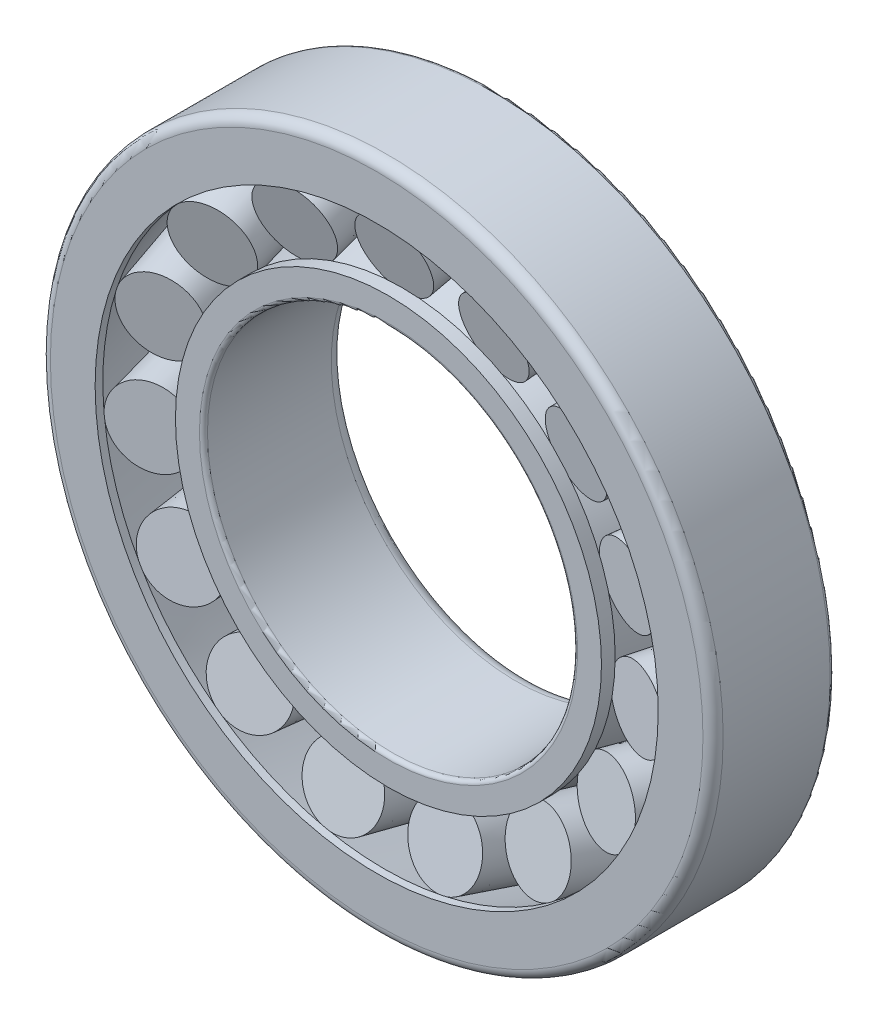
SolidWorks part; units mm, degrees
ref_plane "Front Plane" through (0, 0, 0) normal (0, 0, 1) x (1, 0, 0)
ref_plane "Top Plane" through (0, 0, 0) normal (0, 1, 0) x (1, 0, 0)
ref_plane "Right Plane" through (0, 0, 0) normal (1, 0, 0) x (0, 0, -1)
sketch "BaseSke" plane through (0, 0, 0) normal (1, 0, 0) x (0, 0, -1)
  line L0 (-47.2296, 0) -> (24.6132, 0) construction
  line L2 (0, 129.5214) -> (0, -86.3012) construction
  line L3 (8.7886, 44.1906) -> (-31.5386, 33.3094) construction
  line L4 (-22.75, 50) -> (-4.75, 50) construction
  line L5 (-21, 27.5) -> (0, 27.5) construction
  line L6 (-11.375, 38.75) -> (-18.4266, 64.8845) construction
  line L7 (-21.6125, 41.8693) -> (-5.8875, 46.5571)
  line L8 (-5.8875, 46.5571) -> (-4.2963, 40.66)
  line L9 (-4.2963, 40.66) -> (-20.1332, 36.3869)
  line L10 (-20.1332, 36.3869) -> (-21.6125, 41.8693)
  line L11 (-22.75, 50) -> (-22.75, 41.85) construction
  line L12 (-21.6073, 41.85) -> (-4.75, 46.8754) construction
  line L13 (-4.75, 50) -> (-4.75, 46.8754) construction
  line L14 (-21.6073, 41.85) -> (-22.75, 41.85) construction
  line L15 (-18.6539, 30.9044) -> (-2.7051, 34.7628) construction
  line L16 (-21, 27.5) -> (-21, 31.6627) construction
  line L17 (-21, 31.6627) -> (-18.9621, 31.6627) construction
  line L18 (0, 35.5211) -> (0, 27.5) construction
  line L19 (-18.9621, 31.6627) -> (-18.7642, 30.9292) construction
  line L20 (-18.7642, 30.9292) -> (-2.6209, 34.8346) construction
  line L21 (-2.6209, 34.8346) -> (-2.8062, 35.5211) construction
  line L22 (-2.8062, 35.5211) -> (0, 35.5211) construction
  dimension "D2" = 11.375
  dimension "D1" = 0.02
  dimension "Outer_Thickness" = 18
  dimension "Bearing_Outside_Diameter" = 100
  dimension "Bearing_Inside_Diameter" = 55
  dimension "Inner_Thickness" = 21
  dimension "Bearing_Thickness" = 22.75
  dimension "Angle" = 15.1
  dimension "D3" = 77.5
  dimension "D4" = 1.1375
  dimension "D5" = 1.1375
  dimension "D6" = 1.5
  dimension "D7" = 0.1
  dimension "Roller_diameter" = 83.7
  dimension "D8" = 0.7583
  dimension "D9" = 0.05
  dimension "D10" = 0.1
  dimension "D11" = 0.7583
revolve "Roller" add sketch "BaseSke" angle 360 about L3
sketch "OuterRaceSke" plane through (0, 0, 0) normal (1, 0, 0) x (0, 0, -1)
  line L0 (-21.6073, 41.85) -> (-22.75, 41.85) construction
  line L1 (-21.6073, 41.85) -> (-4.75, 46.8754) construction
  line L2 (-4.75, 50) -> (-4.75, 46.8754) construction
  line L3 (-22.75, 50) -> (-4.75, 50) construction
  line L4 (-22.75, 50) -> (-22.75, 41.85) construction
  line L5 (-21.6073, 41.85) -> (-22.75, 41.85)
  line L6 (-21.6073, 41.85) -> (-4.75, 46.8754)
  line L7 (-4.75, 50) -> (-4.75, 46.8754)
  line L8 (-22.75, 50) -> (-4.75, 50)
  line L9 (-22.75, 50) -> (-22.75, 41.85)
  line L10 (-60.3939, 0) -> (35.9926, 0) construction
revolve "OuterRace" add sketch "OuterRaceSke" angle 360 about L10
sketch "InnerRaceSke" plane through (0, 0, 0) normal (1, 0, 0) x (0, 0, -1)
  line L0 (-21, 27.5) -> (0, 27.5) construction
  line L1 (-21, 27.5) -> (-21, 31.6627) construction
  line L2 (-21, 31.6627) -> (-18.9621, 31.6627) construction
  line L3 (-18.9621, 31.6627) -> (-18.7642, 30.9292) construction
  line L4 (-18.7642, 30.9292) -> (-2.6209, 34.8346) construction
  line L5 (-2.6209, 34.8346) -> (-2.8062, 35.5211) construction
  line L6 (-2.8062, 35.5211) -> (0, 35.5211) construction
  line L7 (0, 35.5211) -> (0, 27.5) construction
  line L8 (-21, 27.5) -> (0, 27.5)
  line L9 (-21, 27.5) -> (-21, 31.6627)
  line L10 (-21, 31.6627) -> (-18.9621, 31.6627)
  line L11 (-18.9621, 31.6627) -> (-18.7642, 30.9292)
  line L12 (-18.7642, 30.9292) -> (-2.6209, 34.8346)
  line L13 (-2.6209, 34.8346) -> (-2.8062, 35.5211)
  line L14 (-2.8062, 35.5211) -> (0, 35.5211)
  line L15 (0, 35.5211) -> (0, 27.5)
  line L16 (-58.1022, 0) -> (39.538, 0) construction
revolve "InnerRace" add sketch "InnerRaceSke" angle 360 about L16
fillet "Fillet1" radius 0.6 2 edges at (50, 0, 4.75) (27.5, 0, 21)
fillet "InnerFillet" radius 2 1 edges at (27.5, 0, 0)
fillet "OuterFillet" radius 1.5 1 edges at (50, 0, 22.75)
pattern_circular "CirPatternBall" count 15 over 360 about axis through (0, 0, 0) along (0, 0, 1) of "Roller"
sketch "Sketch4" plane through (0, 0, 0) normal (1, 0, 0) x (0, 0, -1)
  line L0 (-21.6125, 41.8693) -> (-5.8875, 46.5571)
  line L1 (-5.8875, 46.5571) -> (-2.7051, 34.7628)
  line L2 (-2.7051, 34.7628) -> (-18.6539, 30.9044)
  line L3 (-18.6539, 30.9044) -> (-21.6125, 41.8693)
  line L4 (-40.3293, 0) -> (19.5574, 0) construction
revolve "Simplified" [suppressed] add sketch "Sketch4" angle 360 about L4
equation "\"D2@BaseSke\" = \"Bearing_Thickness@BaseSke\"/2"
equation "\"D3@BaseSke\" =  ( \"Bearing_Outside_Diameter@BaseSke\" + \"Bearing_Inside_Diameter@BaseSke\" )  / 2"
equation "\"Roller_diameter@BaseSke\" = \"D3@BaseSke\"*1.08"
equation "\"D4@BaseSke\" = \"Bearing_Thickness@BaseSke\"/20"
equation "\"D5@BaseSke\" = \"Bearing_Thickness@BaseSke\" / 20"
equation "\"D8@BaseSke\" = \"Bearing_Thickness@BaseSke\"/30"
equation "\"D11@BaseSke\" = \"D8@BaseSke\""
equation "\"D1@CirPatternBall\" = int(  \"D3@BaseSke\" *  pi  /  ( \"Bearing_Outside_Diameter@BaseSke\" - \"Bearing_Inside_Diameter@BaseSke\" )  *2.8 ) "
